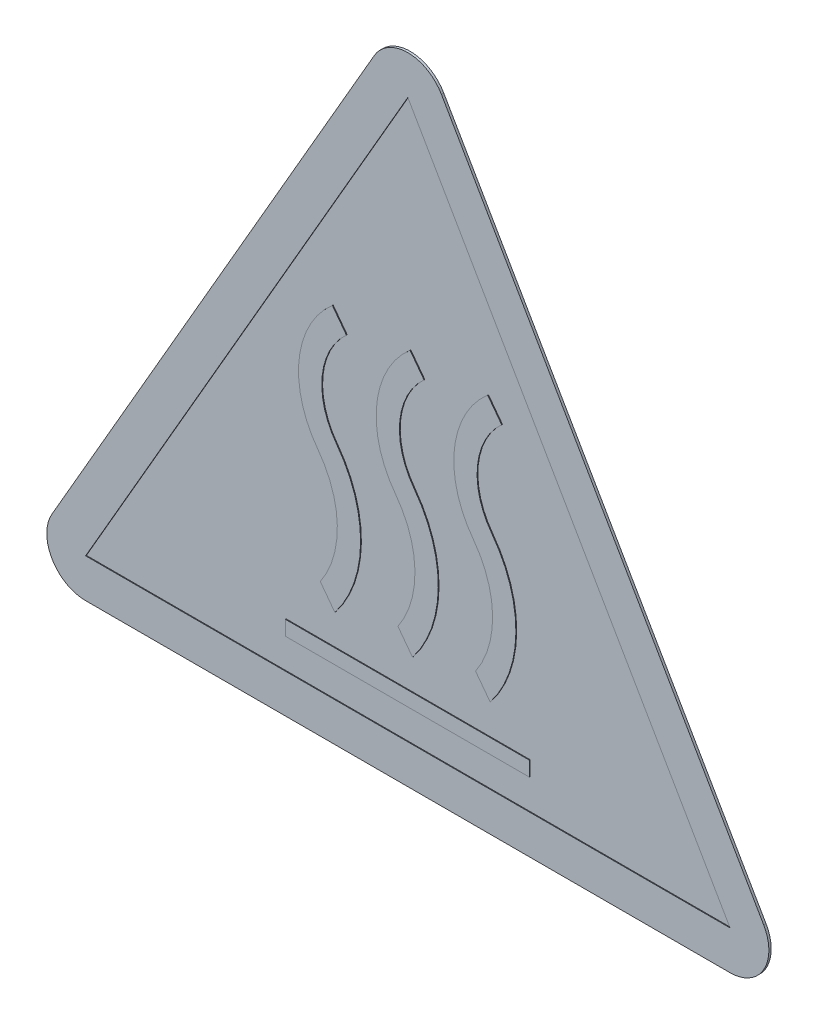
SolidWorks part; units mm, degrees
ref_plane "Plan de face" through (0, 0, 0) normal (0, 0, 1) x (1, 0, 0)
ref_plane "Plan de dessus" through (0, 0, 0) normal (0, 1, 0) x (1, 0, 0)
ref_plane "Plan de droite" through (0, 0, 0) normal (1, 0, 0) x (0, 0, -1)
sketch "Esquisse1" plane through (0, 0, 0) normal (0, 0, 1) x (1, 0, 0)
  line L0 (-41.5, 0) -> (41.5, 0)
  line L1 (45.8301, 7.5) -> (4.3301, 79.3801)
  line L2 (-4.3301, 79.3801) -> (-45.8301, 7.5)
  arc A0 (4.3301, 79.3801) -> (-4.3301, 79.3801) centre (0, 76.8801) ccw
  arc A1 (41.5, 0) -> (45.8301, 7.5) centre (41.5, 5) ccw
  arc A2 (-41.5, 0) -> (-45.8301, 7.5) centre (-41.5, 5) cw
  dimension "D1" = 5
  dimension "D2" = 83
  dimension "D3" = 83
  dimension "D4" = 83
extrude "Extrusion1" add sketch "Esquisse1" along normal blind 0.3
sketch "Esquisse2" plane through (0, 0, 0.3) normal (0, 0, 1) x (1, 0, 0)
  line L0 (-1.2769, 17.2525) -> (0.6024, 14.7469)
  line L1 (2.0871, 46.411) -> (0.282, 48.8177)
  line L2 (-11.5811, 24.3288) -> (8.4189, 39.3288) construction
  line L3 (-11.2769, 17.2525) -> (-9.3976, 14.7469)
  line L4 (-15.7722, 10.7841) -> (15.6611, 10.7841)
  line L5 (-15.7722, 10.7841) -> (-15.7722, 8.8958)
  line L6 (0, 76.8801) -> (-41.5, 5)
  line L7 (-41.5, 5) -> (41.5, 5)
  line L8 (41.5, 5) -> (0, 76.8801)
  line L9 (0, 76.8801) -> (-41.5, 5)
  line L10 (-41.5, 5) -> (41.5, 5)
  line L11 (41.5, 5) -> (0, 76.8801)
  line L12 (-15.7722, 8.8958) -> (15.6611, 8.8958)
  line L13 (15.6611, 10.7841) -> (15.6611, 8.8958)
  line L14 (-7.9129, 46.411) -> (-9.718, 48.8177)
  line L15 (-21.5811, 24.3288) -> (-1.5811, 39.3288) construction
  line L16 (8.7231, 17.2525) -> (10.6024, 14.7469)
  line L17 (12.0871, 46.411) -> (10.282, 48.8177)
  line L18 (-1.5811, 24.3288) -> (18.4189, 39.3288) construction
  arc A0 (-1.2769, 17.2525) -> (-1.5811, 31.8288) centre (-11.5811, 24.3288) ccw
  arc A1 (0.282, 48.8177) -> (-1.5811, 31.8288) centre (8.4189, 39.3288) ccw
  arc A2 (2.0871, 46.411) -> (0.8189, 33.6288) centre (8.4189, 39.3288) ccw
  arc A3 (-11.2769, 17.2525) -> (-11.5811, 31.8288) centre (-21.5811, 24.3288) ccw
  arc A4 (-9.718, 48.8177) -> (-11.5811, 31.8288) centre (-1.5811, 39.3288) ccw
  arc A5 (-7.9129, 46.411) -> (-9.1811, 33.6288) centre (-1.5811, 39.3288) ccw
  arc A6 (-9.3976, 14.7469) -> (-9.1811, 33.6288) centre (-21.5811, 24.3288) ccw
  arc A7 (0.6024, 14.7469) -> (0.8189, 33.6288) centre (-11.5811, 24.3288) ccw
  arc A8 (8.7231, 17.2525) -> (8.4189, 31.8288) centre (-1.5811, 24.3288) ccw
  arc A9 (10.282, 48.8177) -> (8.4189, 31.8288) centre (18.4189, 39.3288) ccw
  arc A10 (12.0871, 46.411) -> (10.8189, 33.6288) centre (18.4189, 39.3288) ccw
  arc A11 (10.6024, 14.7469) -> (10.8189, 33.6288) centre (-1.5811, 24.3288) ccw
  dimension "D2" = 25
  dimension "D3" = 25
  dimension "D4" = 15
  dimension "D1" = 5
  dimension "D6" = 3
extrude "Enlèv. mat.-Extru.1" cut sketch "Esquisse2" against normal blind 0.1
